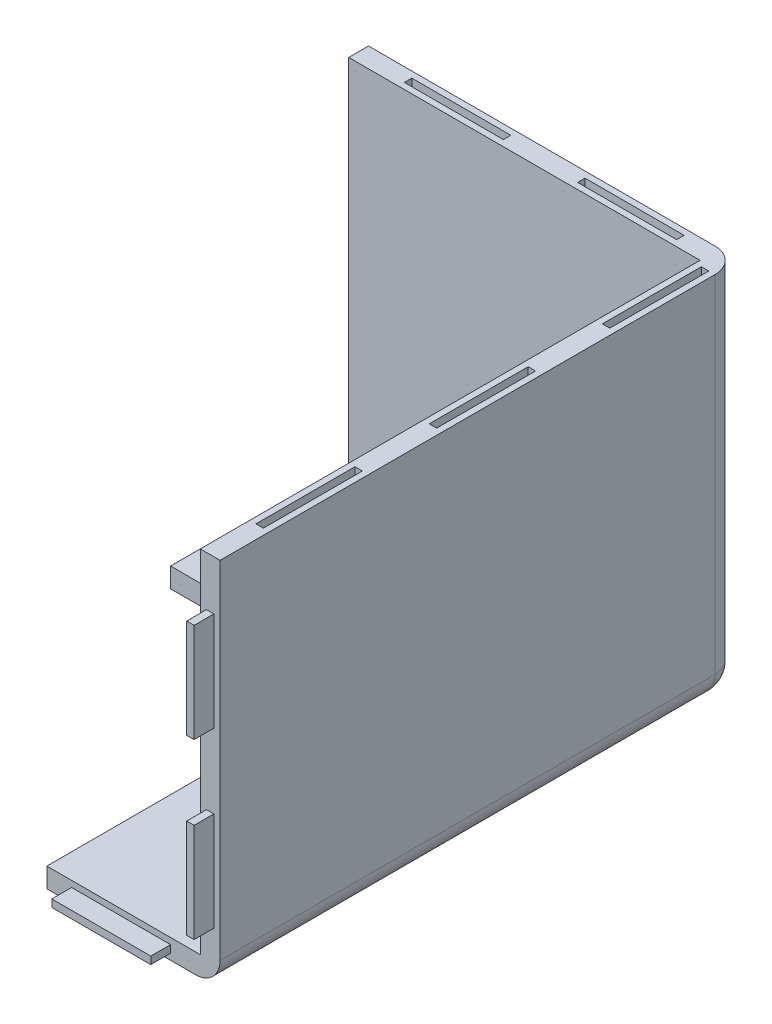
SolidWorks part; units mm, degrees
ref_plane "Alzado" through (0, 0, 0) normal (0, 0, 1) x (1, 0, 0)
ref_plane "Planta" through (0, 0, 0) normal (0, 1, 0) x (1, 0, 0)
ref_plane "Vista lateral" through (0, 0, 0) normal (1, 0, 0) x (0, 0, -1)
sketch "Croquis1" plane through (0, 0, 0) normal (0, 1, 0) x (1, 0, 0)
  line L1 (0, 0) -> (150, 0)
  line L2 (0, 0) -> (0, 210)
  line L3 (0, 210) -> (150, 210)
  line L4 (150, 0) -> (150, 210)
  dimension "D1" = 150
  dimension "D2" = 210
extrude "Saliente-Extruir1" add sketch "Croquis1" along normal blind 150
sketch "Croquis2" plane through (0, 150, 0) normal (0, 1, 0) x (1, 0, 0)
  line L1 (0, 202) -> (142, 202)
  line L2 (0, 202) -> (0, 0)
  line L3 (0, 0) -> (142, 0)
  line L4 (142, 202) -> (142, 0)
  line L5 (150, 210) -> (0, 210) construction
  line L8 (0, 0) -> (150, 0) construction
  line L9 (0, 210) -> (0, 0) construction
  line L10 (150, 0) -> (150, 210) construction
  dimension "D1" = 8
  dimension "D2" = 8
  dimension "D4" = 0
extrude "Cortar-Extruir1" cut sketch "Croquis2" against normal blind 142
sketch "Croquis8" plane through (0, 150, 0) normal (0, 1, 0) x (1, 0, 0)
  line L0 (0, 210) -> (0, 202) construction
  line L1 (20, 207.5) -> (60, 207.5)
  line L2 (20, 207.5) -> (20, 204.5)
  line L3 (20, 204.5) -> (60, 204.5)
  line L4 (60, 207.5) -> (60, 204.5)
  line L5 (90, 207.5) -> (130, 207.5)
  line L6 (90, 207.5) -> (90, 204.5)
  line L7 (90, 204.5) -> (130, 204.5)
  line L8 (130, 207.5) -> (130, 204.5)
  line L9 (150, 210) -> (0, 210) construction
  line L10 (142, 0) -> (150, 0) construction
  line L11 (144.5, 20) -> (147.5, 20)
  line L12 (144.5, 20) -> (144.5, 60)
  line L13 (144.5, 60) -> (147.5, 60)
  line L14 (147.5, 20) -> (147.5, 60)
  line L15 (144.5, 90) -> (147.5, 90)
  line L16 (144.5, 90) -> (144.5, 130)
  line L17 (144.5, 130) -> (147.5, 130)
  line L18 (147.5, 90) -> (147.5, 130)
  line L19 (144.5, 160) -> (147.5, 160)
  line L20 (144.5, 160) -> (144.5, 200)
  line L21 (144.5, 200) -> (147.5, 200)
  line L22 (147.5, 160) -> (147.5, 200)
  line L23 (150, 0) -> (150, 210) construction
  dimension "D1" = 3
  dimension "D2" = 3
  dimension "D3" = 20
  dimension "D4" = 40
  dimension "D5" = 30
  dimension "D6" = 40
  dimension "D7" = 2.5
  dimension "D8" = 2.5
  dimension "D9" = 40
  dimension "D10" = 40
  dimension "D11" = 40
  dimension "D12" = 20
  dimension "D13" = 30
  dimension "D14" = 30
  dimension "D15" = 3
  dimension "D16" = 3
  dimension "D17" = 3
  dimension "D18" = 2.5
  dimension "D19" = 2.5
  dimension "D20" = 2.5
sketch "Croquis9" plane through (0, 0, 0) normal (-1, 0, 0) x (0, 0, 1)
  line L0 (-210, 150) -> (-202, 150) construction
  line L1 (-207.5, 130) -> (-204.5, 130)
  line L2 (-207.5, 130) -> (-207.5, 90)
  line L3 (-207.5, 90) -> (-204.5, 90)
  line L4 (-204.5, 130) -> (-204.5, 90)
  line L5 (-207.5, 60) -> (-204.5, 60)
  line L6 (-207.5, 60) -> (-207.5, 20)
  line L7 (-207.5, 20) -> (-204.5, 20)
  line L8 (-204.5, 60) -> (-204.5, 20)
  line L9 (-20, 5.5) -> (-60, 5.5)
  line L10 (-20, 5.5) -> (-20, 2.5)
  line L11 (-20, 2.5) -> (-60, 2.5)
  line L12 (-60, 5.5) -> (-60, 2.5)
  line L13 (-90, 5.5) -> (-130, 5.5)
  line L14 (-90, 5.5) -> (-90, 2.5)
  line L15 (-90, 2.5) -> (-130, 2.5)
  line L16 (-130, 5.5) -> (-130, 2.5)
  line L17 (-160, 5.5) -> (-200, 5.5)
  line L18 (-160, 5.5) -> (-160, 2.5)
  line L19 (-160, 2.5) -> (-200, 2.5)
  line L20 (-200, 5.5) -> (-200, 2.5)
  line L21 (0, 8) -> (0, 0) construction
  line L22 (-210, 0) -> (0, 0) construction
  line L23 (-210, 150) -> (-210, 0) construction
  dimension "D1" = 40
  dimension "D2" = 40
  dimension "D3" = 30
  dimension "D4" = 20
  dimension "D5" = 40
  dimension "D6" = 40
  dimension "D7" = 40
  dimension "D8" = 30
  dimension "D9" = 30
  dimension "D10" = 20
  dimension "D11" = 3
  dimension "D12" = 3
  dimension "D13" = 3
  dimension "D14" = 2.5
  dimension "D15" = 2.5
  dimension "D16" = 2.5
  dimension "D17" = 3
  dimension "D18" = 3
  dimension "D19" = 2.5
  dimension "D20" = 2.5
extrude "Cortar-Extruir5" cut sketch "Croquis9" against normal blind 8
sketch "Croquis10" plane through (0, 0, 0) normal (0, 0, 1) x (1, 0, 0)
  line L0 (142, 150) -> (150, 150) construction
  line L1 (144.5, 130) -> (147.5, 130)
  line L2 (144.5, 130) -> (144.5, 90)
  line L3 (144.5, 90) -> (147.5, 90)
  line L4 (147.5, 130) -> (147.5, 90)
  line L5 (144.5, 60) -> (147.5, 60)
  line L6 (144.5, 60) -> (144.5, 20)
  line L7 (144.5, 20) -> (147.5, 20)
  line L8 (147.5, 60) -> (147.5, 20)
  line L9 (20, 5.5) -> (60, 5.5)
  line L10 (20, 5.5) -> (20, 2.5)
  line L11 (20, 2.5) -> (60, 2.5)
  line L12 (60, 5.5) -> (60, 2.5)
  line L13 (90, 5.5) -> (130, 5.5)
  line L14 (90, 5.5) -> (90, 2.5)
  line L15 (90, 2.5) -> (130, 2.5)
  line L16 (130, 5.5) -> (130, 2.5)
  line L17 (150, 150) -> (150, 0) construction
  line L18 (0, 8) -> (0, 0) construction
  line L19 (0, 0) -> (150, 0) construction
  dimension "D1" = 40
  dimension "D2" = 40
  dimension "D3" = 20
  dimension "D4" = 30
  dimension "D5" = 3
  dimension "D6" = 3
  dimension "D7" = 2.5
  dimension "D8" = 2.5
  dimension "D9" = 40
  dimension "D10" = 40
  dimension "D11" = 30
  dimension "D12" = 20
  dimension "D13" = 3
  dimension "D14" = 3
  dimension "D15" = 2.5
  dimension "D16" = 2.5
extrude "Saliente-Extruir6" add sketch "Croquis10" along normal blind 8
fillet "Redondeo2" radius 10 3 edges at (75, 0, -210) (150, 0, -105) (150, 75, -210)
sketch "Croquis11" plane through (0, 0, 0) normal (0, -1, 0) x (1, 0, 0)
  line L0 (20, 8) -> (60, 8) construction
  line L1 (0, 8) -> (80, 8)
  line L2 (0, 8) -> (0, -130)
  line L3 (0, -130) -> (80, -130)
  line L4 (80, 8) -> (80, -130)
  line L5 (0, -200) -> (0, 0) construction
  dimension "D1" = 80
  dimension "D2" = 138
extrude "Cortar-Extruir6" cut sketch "Croquis11" against normal blind 10
extrude "Cortar-Extruir7" cut sketch "Croquis8" against normal blind 10
